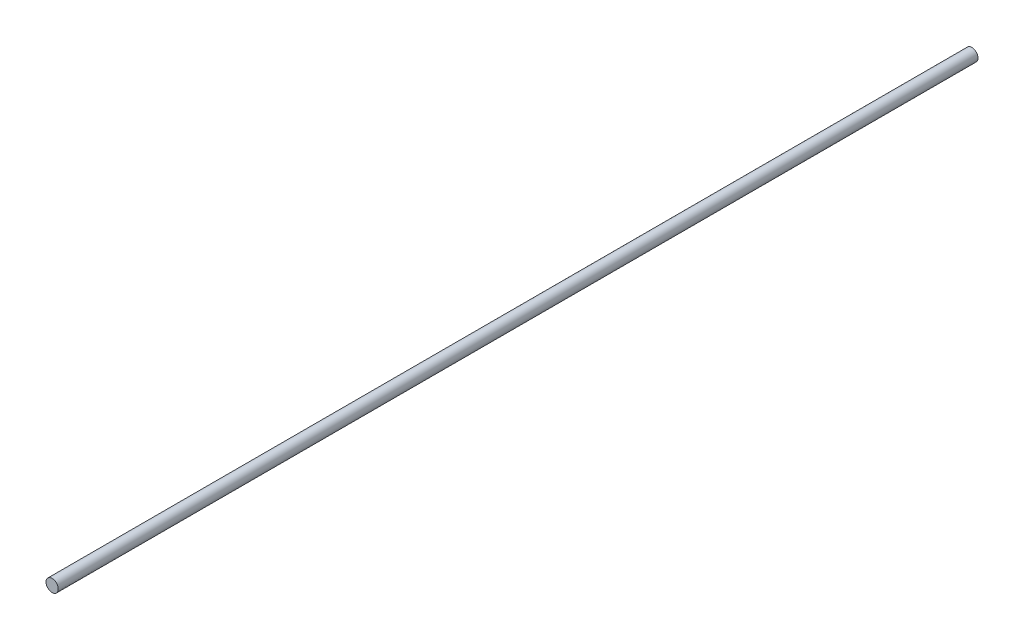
SolidWorks part; units mm, degrees
ref_plane "Front Plane" through (0, 0, 0) normal (0, 0, 1) x (1, 0, 0)
ref_plane "Top Plane" through (0, 0, 0) normal (0, 1, 0) x (1, 0, 0)
ref_plane "Right Plane" through (0, 0, 0) normal (1, 0, 0) x (0, 0, -1)
sketch "Sketch1" plane through (0, 0, 0) normal (0, 0, 1) x (1, 0, 0)
  circle A0 centre (0, 0) radius 3
extrude "Boss-Extrude1" add sketch "Sketch1" along normal blind 450
